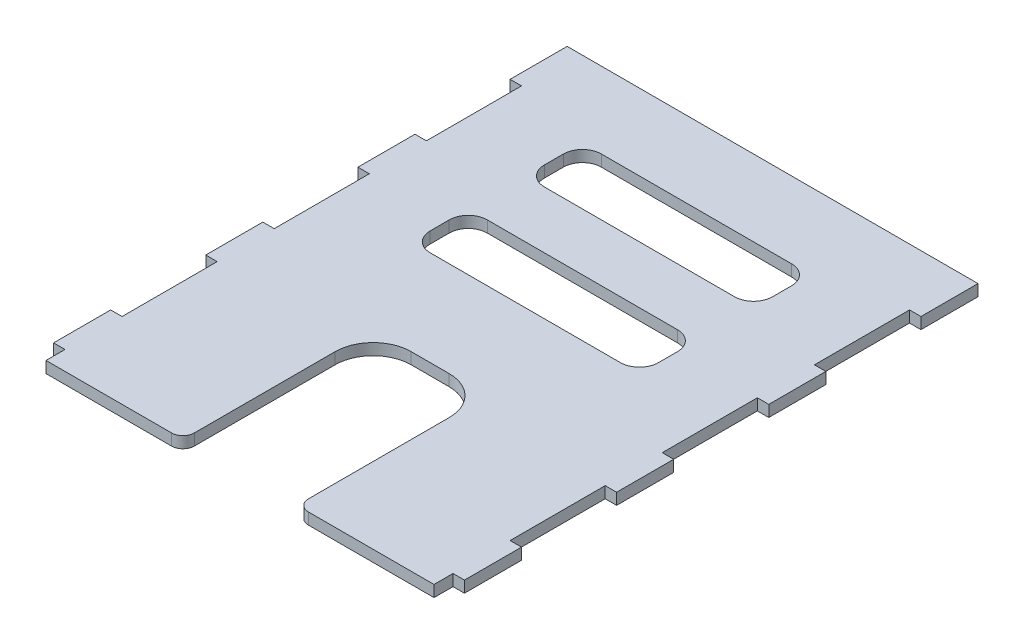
SolidWorks part; units mm, degrees
ref_plane "Front Plane" through (0, 0, 0) normal (0, 0, 1) x (1, 0, 0)
ref_plane "Top Plane" through (0, 0, 0) normal (0, 1, 0) x (1, 0, 0)
ref_plane "Right Plane" through (0, 0, 0) normal (1, 0, 0) x (0, 0, -1)
sketch "Sketch1" plane through (0, 0, 0) normal (0, 1, 0) x (1, 0, 0)
  line L0 (0, 0) -> (102, 0)
  line L1 (102, 0) -> (102, 145)
  line L2 (102, 145) -> (0, 145)
  line L3 (0, 145) -> (0, 0)
extrude "Boss-Extrude1" add sketch "Sketch1" along normal blind 3
sketch "Sketch2" plane through (0, 3, 0) normal (0, 1, 0) x (1, 0, 0)
  line L0 (102, 145) -> (102, 140) construction
  line L1 (102, 0) -> (102, 145) construction
  line L2 (102, 140) -> (102, 125) construction
  line L3 (102, 125) -> (102, 100) construction
  line L4 (102, 100) -> (102, 85) construction
  line L5 (102, 85) -> (102, 60) construction
  line L6 (102, 60) -> (102, 45) construction
  line L7 (102, 45) -> (102, 20) construction
  line L8 (102, 20) -> (102, 5) construction
  line L9 (102, 140) -> (105, 140)
  line L10 (105, 140) -> (105, 125)
  line L11 (105, 125) -> (102, 125)
  line L12 (102, 125) -> (102, 140)
  line L13 (102, 85) -> (105, 85)
  line L14 (105, 85) -> (105, 100)
  line L15 (105, 100) -> (102, 100)
  line L16 (102, 100) -> (102, 85)
  line L17 (102, 45) -> (105, 45)
  line L18 (105, 45) -> (105, 60)
  line L19 (105, 60) -> (102, 60)
  line L20 (102, 60) -> (102, 45)
  line L21 (102, 20) -> (102, 5)
  line L22 (102, 5) -> (105, 5)
  line L23 (105, 5) -> (105, 20)
  line L24 (105, 20) -> (102, 20)
  line L25 (51, 145) -> (51, 0) construction
  line L26 (102, 145) -> (0, 145) construction
  line L27 (0, 0) -> (102, 0) construction
  line L28 (0, 20) -> (0, 5) construction
  line L29 (0, 45) -> (0, 20) construction
  line L30 (0, 60) -> (0, 45) construction
  line L31 (0, 85) -> (0, 60) construction
  line L32 (0, 100) -> (0, 85) construction
  line L33 (0, 125) -> (0, 100) construction
  line L34 (0, 140) -> (0, 125) construction
  line L35 (0, 145) -> (0, 140) construction
  line L36 (-3, 20) -> (0, 20)
  line L37 (-3, 5) -> (-3, 20)
  line L38 (0, 5) -> (-3, 5)
  line L39 (0, 20) -> (0, 5)
  line L40 (0, 60) -> (0, 45)
  line L41 (-3, 60) -> (0, 60)
  line L42 (-3, 45) -> (-3, 60)
  line L43 (0, 45) -> (-3, 45)
  line L44 (0, 100) -> (0, 85)
  line L45 (-3, 100) -> (0, 100)
  line L46 (-3, 85) -> (-3, 100)
  line L47 (0, 85) -> (-3, 85)
  line L48 (0, 125) -> (0, 140)
  line L49 (-3, 125) -> (0, 125)
  line L50 (-3, 140) -> (-3, 125)
  line L51 (0, 140) -> (-3, 140)
  dimension "D1" = 5
  dimension "D2" = 15
  dimension "D3" = 25
  dimension "D4" = 15
  dimension "D5" = 25
  dimension "D6" = 15
  dimension "D7" = 25
  dimension "D8" = 15
extrude "Boss-Extrude2" add sketch "Sketch2" against normal blind 3
sketch "Sketch3" plane through (0, 3, 0) normal (0, 1, 0) x (1, 0, 0)
  line L0 (51, 0) -> (51, 50) construction
  line L1 (0, 0) -> (102, 0) construction
  line L2 (51, 50) -> (66, 50) construction
  line L3 (51, 50) -> (36, 50) construction
  line L4 (36, 0) -> (36, 50)
  line L5 (36, 50) -> (66, 50)
  line L6 (66, 50) -> (66, 0)
  line L7 (66, 0) -> (36, 0)
extrude "Cut-Extrude1" cut sketch "Sketch3" against normal blind 10
fillet "Fillet1" radius 10 2 edges at (66, 1.5, -50) (36, 1.5, -50)
fillet "Fillet2" radius 3 2 edges at (66, 1.5, 0) (36, 1.5, 0)
sketch "Sketch4" plane through (0, 3, 0) normal (0, 1, 0) x (1, 0, 0)
  line L0 (51, 145) -> (51, 120) construction
  line L1 (102, 145) -> (0, 145) construction
  line L2 (51, 120) -> (21, 120) construction
  line L3 (21, 120) -> (21, 105) construction
  line L4 (21, 105) -> (81, 105) construction
  line L5 (81, 105) -> (81, 120) construction
  line L6 (81, 120) -> (51, 120) construction
  line L7 (51, 105) -> (51, 90) construction
  line L8 (51, 90) -> (81, 90) construction
  line L9 (81, 90) -> (81, 75) construction
  line L10 (81, 75) -> (21, 75) construction
  line L11 (21, 75) -> (21, 90) construction
  line L12 (21, 90) -> (51, 90) construction
  line L13 (21, 120) -> (81, 120)
  line L14 (81, 120) -> (81, 105)
  line L15 (81, 105) -> (21, 105)
  line L16 (21, 105) -> (21, 120)
  line L17 (21, 90) -> (21, 75)
  line L18 (21, 75) -> (81, 75)
  line L19 (81, 75) -> (81, 90)
  line L20 (81, 90) -> (21, 90)
extrude "Cut-Extrude2" cut sketch "Sketch4" against normal blind 10
fillet "Fillet3" radius 5 8 edges at (21, 1.5, -75) (81, 1.5, -75) (81, 1.5, -90) (21, 1.5, -90) (21, 1.5, -105) (81, 1.5, -105) (81, 1.5, -120) (21, 1.5, -120)
sketch "Sketch5" plane through (0, 3, 0) normal (0, 1, 0) x (1, 0, 0)
  line L0 (102, 140) -> (102, 145)
  line L1 (102, 145) -> (0, 145)
  line L2 (0, 145) -> (0, 140)
  line L3 (0, 140) -> (102, 140)
extrude "Cut-Extrude3" cut sketch "Sketch5" against normal blind 10
